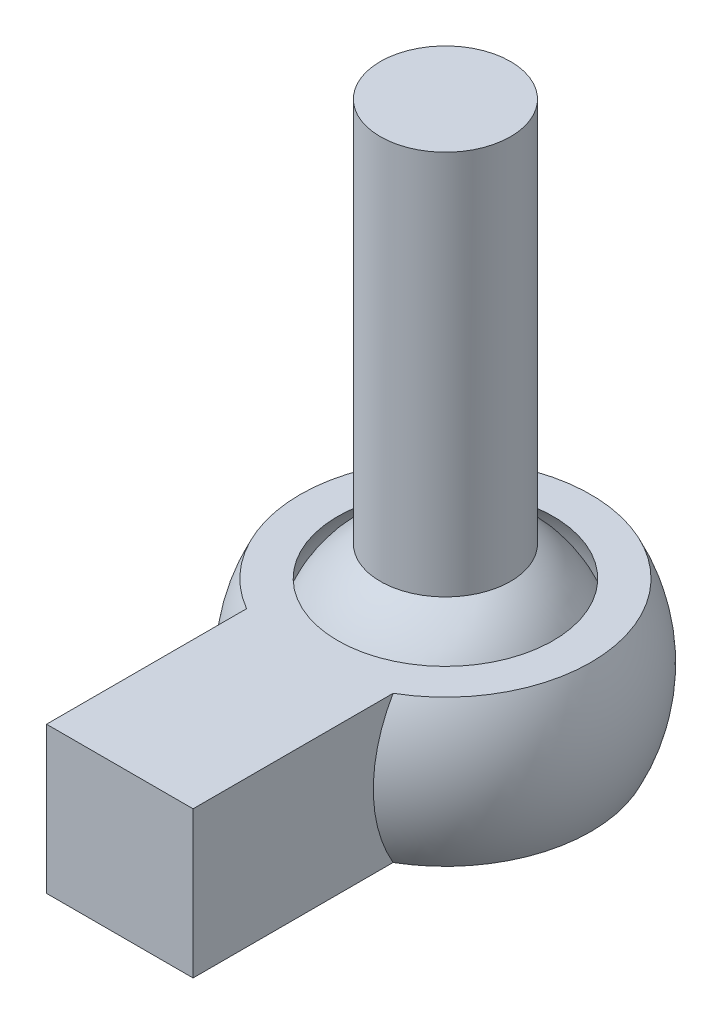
SolidWorks part; units mm, degrees
ref_plane "Front Plane" through (0, 0, 0) normal (0, 0, 1) x (1, 0, 0)
ref_plane "Top Plane" through (0, 0, 0) normal (0, 1, 0) x (1, 0, 0)
ref_plane "Right Plane" through (0, 0, 0) normal (1, 0, 0) x (0, 0, -1)
sketch "Sketch1" plane through (0, 0, 0) normal (1, 0, 0) x (0, 0, -1)
  line L3 (0, 0) -> (0, 7.5) construction
  line L5 (-6.6144, 4.5) -> (-8.9303, 4.5)
  line L6 (-6.6144, -4.5) -> (-8.9303, -4.5)
  arc A0 (-8.9303, 4.5) -> (-8.9303, -4.5) centre (0, 0) ccw
  arc A1 (-6.6144, 4.5) -> (-6.6144, -4.5) centre (0, 0) ccw
  dimension "D1" = 20
  dimension "D2" = 16
revolve "Revolve2" add sketch "Sketch1" angle 360 about L3
sketch "Sketch2" plane through (0, 0, 0) normal (0, 0, 1) x (1, 0, 0)
  line L0 (0, 0) -> (0, 7.5) construction
  line L1 (0, 0) -> (0, -7.5) construction
  line L2 (0, -7.5) -> (0, 7.5)
  arc A0 (0, -7.5) -> (0, 7.5) centre (0, 0) ccw
  dimension "D1" = 15
revolve "Revolve3" add sketch "Sketch2" angle 360 about L2
sketch "Sketch3" plane through (0, 0, 0) normal (0, 1, 0) x (1, 0, 0)
  circle A0 centre (0, 0) radius 4
  dimension "D1" = 8
extrude "Boss-Extrude1" add sketch "Sketch3" along normal blind 30
sketch "Sketch4" plane through (0, 0, 0) normal (0, 0, 1) x (1, 0, 0)
  line L0 (8.9303, 4.5) -> (-8.9303, 4.5) construction
  line L1 (4.5, -4.5) -> (-4.5, -4.5)
  line L2 (4.5, -4.5) -> (4.5, 4.5)
  line L3 (4.5, 4.5) -> (-4.5, 4.5)
  line L4 (-4.5, -4.5) -> (-4.5, 4.5)
  line L5 (4.5, -4.5) -> (-4.5, 4.5) construction
  line L6 (4.5, 4.5) -> (-4.5, -4.5) construction
  point P0 (0, 0)
  dimension "D1" = 9
extrude "Boss-Extrude3" add sketch "Sketch4" against normal up to next from offset 30
sketch "Sketch5" plane through (4.5, 0, 0) normal (1, 0, 0) x (0, 0, -1)
  line L0 (-7.7136, -4.5) -> (-30, -4.5) construction
  line L1 (-30, 4.5) -> (-20, 4.5)
  line L2 (-30, 4.5) -> (-30, -4.5)
  line L3 (-30, -4.5) -> (-20, -4.5)
  line L4 (-20, 4.5) -> (-20, -4.5)
  dimension "D1" = 10
extrude "Cut-Extrude1" cut sketch "Sketch5" against normal through all contours L2 L1 L4 L3
